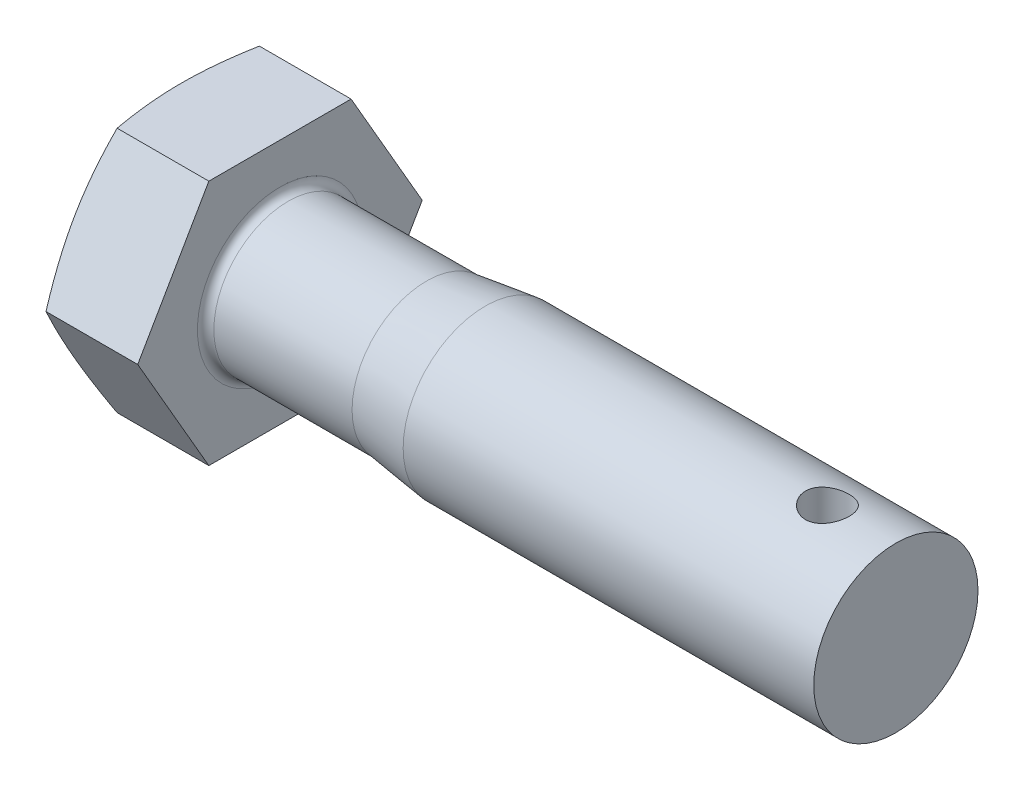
SolidWorks part; units mm, degrees
ref_plane "Front" through (0, 0, 0) normal (0, 0, 1) x (1, 0, 0)
ref_plane "Top" through (0, 0, 0) normal (0, 1, 0) x (1, 0, 0)
ref_plane "Right" through (0, 0, 0) normal (1, 0, 0) x (0, 0, -1)
sketch "Sketch1" plane through (0, 0, 0) normal (1, 0, 0) x (0, 0, -1)
  line L1 (5.1962, -9) -> (10.3923, 0)
  line L2 (10.3923, 0) -> (5.1962, 9)
  line L3 (5.1962, 9) -> (-5.1962, 9)
  line L4 (-5.1962, 9) -> (-10.3923, 0)
  line L5 (-10.3923, 0) -> (-5.1962, -9)
  line L6 (-5.1962, -9) -> (5.1962, -9)
  circle A0 centre (0, 0) radius 9 construction
  dimension "s" = 18
extrude "BaseHead" add sketch "Sketch1" along normal blind 7.5
ref_plane "Plane1" through (22.5, 0, 0) normal (1, 0, 0) x (0, 0, -1)
sketch "Sketch2" plane through (7.5, 0, 0) normal (1, 0, 0) x (0, 0, -1)
  circle A0 centre (0, 0) radius 6
  dimension "d" = 12
extrude "BaseBody" add sketch "Sketch2" along normal blind 45
sketch "Sketch3" plane through (3.1612, 0, 2.6123) normal (0, 1, 0) x (0, 0, -1)
  line L0 (2.6123, 2.0714) -> (2.6123, -1.5224) construction
  line L2 (13.0046, 3.1612) -> (13.0046, 2.3633)
  line L3 (13.0046, 2.3633) -> (10.8123, 3.1612)
  line L5 (10.8123, 3.1612) -> (13.0046, 3.1612)
  dimension "D1" = 20
  dimension "dw" = 16.4
revolve "HeadChamfer" cut sketch "Sketch3" angle 360 about L0
sketch "Sketch4" plane through (0, 0, 0) normal (1, 0, 0) x (0, 0, -1)
  circle A0 centre (0, 0) radius 6.85
  dimension "da" = 13.7
extrude "Cut-Extrude1" cut sketch "Sketch4" along normal blind 1.5
sketch "Sketch5" plane through (-2.9296, 0, 7.9296) normal (0, 1, 0) x (0, 0, -1)
  line L0 (7.9296, -2.9296) -> (7.9296, -19.1832) construction
  line L1 (18.3219, -10.4296) -> (13.1258, -10.4296) construction
  line L2 (13.9296, -25.4296) -> (13.3611, -21.1296)
  line L3 (10.9296, -2.9296) -> (10.9296, -19.1832) construction
  line L4 (13.3611, -21.1296) -> (13.3611, -10.4296)
  line L5 (13.9296, -55.4296) -> (13.9296, -10.4296) construction
  line L6 (13.3611, -10.4296) -> (18.7926, -10.4296)
  line L7 (18.7926, -10.4296) -> (18.7926, -25.4296)
  line L8 (18.7926, -25.4296) -> (13.9296, -25.4296)
  line L9 (1.9296, -55.4296) -> (13.9296, -55.4296) construction
  dimension "D1" = 3
  dimension "ds" = 10.863
  dimension "x" = 4.3
  dimension "D3" = 30
  dimension "D4" = 21.726
revolve "Cut-Revolve1" cut sketch "Sketch5" angle 360 about L0
fillet "HeadFillet" radius 0.6 1 edges at (7.5, 0, 5.4315)
sketch "Sketch6" plane through (0, 0, 0) normal (0, 1, 0) x (1, 0, 0)
  line L0 (7.5, -5.1962) -> (7.5, -10.3923) construction
  circle A0 centre (47.5, 0) radius 1.6
  dimension "d1" = 3.2
  dimension "lh" = 40
extrude "Hole" cut sketch "Sketch6" against normal through all and the other way through all
equation "\"D1@Cut-Extrude1\" = 0.2 * \"k@BaseHead\""
equation "\"b@ThreadCosmetic1\" = \"l@BaseBody\" - \"lg@Plane1\""
equation "\"D4@Sketch5\" = 2 * \"ds@Sketch5\""
equation "\"D3@Sketch5\" = \"l@BaseBody\" - \"lg@Plane1\""
